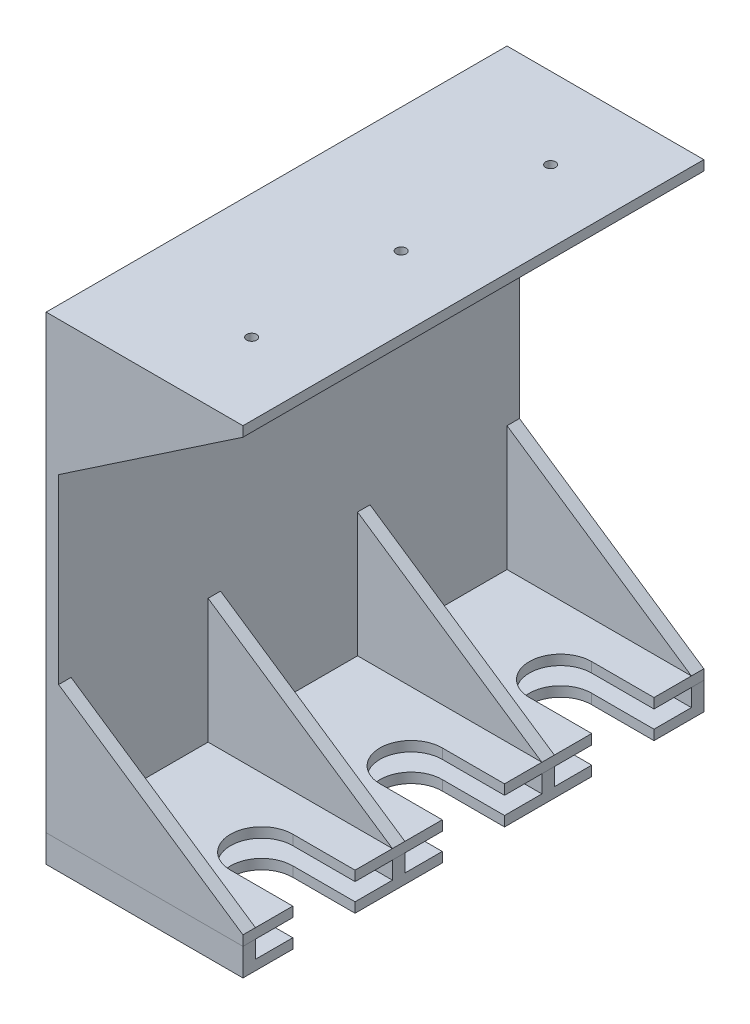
SolidWorks part; units mm, degrees
ref_plane "前视基准面" through (0, 0, 0) normal (0, 0, 1) x (1, 0, 0)
ref_plane "上视基准面" through (0, 0, 0) normal (0, 1, 0) x (1, 0, 0)
ref_plane "右视基准面" through (0, 0, 0) normal (1, 0, 0) x (0, 0, -1)
sketch "草图2" plane through (0, 0, 0) normal (0, 1, 0) x (1, 0, 0)
  line L1 (-1.6914, 66.187) -> (-1.6914, -118.81)
  line L2 (77.3073, -13.812) -> (77.3073, 21.1877)
  line L3 (77.3073, -73.8108) -> (77.3073, -38.8113)
  line L5 (52.2761, 46.1874) -> (77.3073, 46.1874)
  line L7 (52.3077, -13.812) -> (77.3073, -13.812)
  line L18 (52.3077, -38.8113) -> (77.3073, -38.8113)
  line L22 (77.3073, 46.1874) -> (77.3073, 66.187)
  line L28 (52.3077, -98.8102) -> (77.3073, -98.8102)
  line L31 (-1.6914, 66.187) -> (77.3073, 66.187)
  line L34 (52.2761, 21.1877) -> (77.3073, 21.1877)
  line L40 (52.3077, -73.8108) -> (77.3073, -73.8108)
  line L44 (77.3073, -118.81) -> (77.3073, -98.8102)
  line L47 (77.3073, -118.81) -> (-1.6914, -118.81)
  arc A0 (52.2761, 46.1874) -> (52.2761, 21.1877) centre (52.2761, 33.6875) ccw
  arc A1 (52.3077, -13.812) -> (52.3077, -38.8113) centre (52.3077, -26.3116) ccw
  arc A2 (52.3077, -73.8108) -> (52.3077, -98.8102) centre (52.3077, -86.3105) ccw
extrude "凸台-拉伸3" add sketch "草图2" along normal blind 4
ref_plane "基准面9" through (0, 11, 0) normal (0, 1, 0) x (1, 0, 0)
sketch "草图3" plane through (0, 11, 0) normal (0, 1, 0) x (1, 0, 0)
  line L0 (-1.6914, 66.187) -> (-1.6914, -118.81)
  line L1 (77.3073, -13.812) -> (77.3073, 21.1877)
  line L2 (77.3073, -73.8108) -> (77.3073, -38.8113)
  line L3 (52.2761, 46.1874) -> (77.3073, 46.1874)
  line L4 (52.3077, -13.812) -> (77.3073, -13.812)
  line L5 (52.3077, -38.8113) -> (77.3073, -38.8113)
  line L6 (77.3073, 46.1874) -> (77.3073, 66.187)
  line L7 (52.3077, -98.8102) -> (77.3073, -98.8102)
  line L8 (-1.6914, 66.187) -> (77.3073, 66.187)
  line L9 (52.2761, 21.1877) -> (77.3073, 21.1877)
  line L10 (52.3077, -73.8108) -> (77.3073, -73.8108)
  line L11 (77.3073, -118.81) -> (77.3073, -98.8102)
  line L12 (77.3073, -118.81) -> (-1.6914, -118.81)
  arc A0 (52.2761, 46.1874) -> (52.2761, 21.1877) centre (52.2761, 33.6875) ccw
  arc A1 (52.3077, -13.812) -> (52.3077, -38.8113) centre (52.3077, -26.3116) ccw
  arc A2 (52.3077, -73.8108) -> (52.3077, -98.8102) centre (52.3077, -86.3105) ccw
extrude "凸台-拉伸4" add sketch "草图3" along normal blind 4 separate body
sketch "草图4" plane through (0, 4, 0) normal (0, 1, 0) x (1, 0, 0)
  line L0 (2.3086, -113.81) -> (77.3073, -113.81)
  line L1 (-1.6914, 66.187) -> (-1.6914, -118.81) construction
  line L2 (77.3073, -118.81) -> (77.3073, -98.8102) construction
  line L3 (2.3086, -58.81) -> (77.3073, -58.81)
  line L4 (77.3073, -73.8108) -> (77.3073, -38.8113) construction
  line L5 (2.3086, -53.81) -> (77.3073, -53.81)
  line L6 (2.3086, 1.19) -> (77.3073, 1.19)
  line L7 (77.3073, -13.812) -> (77.3073, 21.1877) construction
  line L8 (2.3086, 6.19) -> (77.3073, 6.19)
  line L9 (2.3086, 61.187) -> (77.3073, 61.187)
  line L10 (77.3073, 46.1874) -> (77.3073, 66.187) construction
  line L11 (77.3073, 61.187) -> (77.3073, 66.187)
  line L12 (77.3073, 66.187) -> (-1.6914, 66.187)
  line L13 (-1.6914, 66.187) -> (-1.6914, -118.81)
  line L15 (77.3073, 6.19) -> (77.3073, 1.19)
  line L17 (77.3073, -58.81) -> (77.3073, -53.81)
  line L18 (77.3073, -118.81) -> (77.3073, -113.81)
  line L19 (-1.6914, -118.81) -> (77.3073, -118.81) construction
  line L20 (-1.6914, -118.81) -> (77.3073, -118.81)
  line L23 (2.3086, -113.81) -> (2.3086, -58.81)
  line L24 (2.3086, -53.81) -> (2.3086, 1.19)
  line L25 (2.3086, 6.19) -> (2.3086, 61.187)
  dimension "D1" = 5
  dimension "D3" = 5
  dimension "D5" = 55
  dimension "D6" = 55
  dimension "D7" = 4
extrude "凸台-拉伸5" add sketch "草图4" along normal blind 7
sketch "草图5" plane through (0, 15, 0) normal (0, 1, 0) x (1, 0, 0)
  line L0 (77.3073, 66.187) -> (-1.6914, 66.187) construction
  line L1 (-1.6914, -118.81) -> (3.3086, -118.81)
  line L2 (-1.6914, -118.81) -> (-1.6914, 66.187)
  line L3 (-1.6914, 66.187) -> (3.3086, 66.187)
  line L4 (3.3086, -118.81) -> (3.3086, 66.187)
  dimension "D1" = 5
extrude "凸台-拉伸6" add sketch "草图5" along normal blind 173
ref_plane "基准面10" through (0, 0, 118.81) normal (0, 0, 1) x (1, 0, 0)
sketch "草图6" plane through (0, 0, 118.81) normal (0, 0, 1) x (1, 0, 0)
  line L0 (3.3086, 65) -> (3.3086, 15)
  line L1 (3.3086, 188) -> (3.3086, 15) construction
  line L2 (3.3086, 15) -> (77.3073, 15)
  line L3 (77.3073, 15) -> (3.3086, 65)
  line L4 (3.3086, 188) -> (77.3073, 188)
  line L5 (-1.6914, 188) -> (3.3086, 188) construction
  line L6 (77.3073, 188) -> (3.3086, 138)
  line L7 (3.3086, 138) -> (3.3086, 188)
  dimension "D1" = 50
  dimension "D2" = 50
extrude "凸台-拉伸7" add sketch "草图6" against normal blind 5
ref_plane "基准面11" through (0, 0, 58.81) normal (0, 0, 1) x (1, 0, 0)
sketch "草图7" plane through (0, 0, 58.81) normal (0, 0, 1) x (1, 0, 0)
  line L4 (3.3086, 65) -> (77.3073, 15)
  line L5 (77.3073, 15) -> (3.3086, 15)
  line L6 (3.3086, 15) -> (3.3086, 65)
extrude "凸台-拉伸8" add sketch "草图7" against normal blind 5
ref_plane "基准面12" through (0, 0, -1.19) normal (0, 0, 1) x (1, 0, 0)
sketch "草图8" plane through (0, 0, -1.19) normal (0, 0, 1) x (1, 0, 0)
  line L3 (3.3086, 65) -> (77.3073, 15)
  line L4 (77.3073, 15) -> (3.3086, 65) construction
  line L5 (77.3073, 15) -> (3.3086, 15)
  line L6 (3.3086, 15) -> (3.3086, 65)
extrude "凸台-拉伸9" add sketch "草图8" against normal blind 5
ref_plane "基准面13" through (0, 0, -61.19) normal (0, 0, 1) x (1, 0, 0)
sketch "草图9" plane through (0, 0, -61.19) normal (0, 0, 1) x (1, 0, 0)
  line L0 (3.3086, 138) -> (77.3073, 188)
  line L1 (77.3073, 188) -> (3.3086, 188)
  line L2 (-1.6914, 188) -> (77.3073, 188) construction
  line L3 (3.3086, 188) -> (3.3086, 138)
  line L4 (3.3086, 65) -> (77.3073, 15)
  line L5 (77.3073, 15) -> (3.3086, 15)
  line L6 (3.3086, 15) -> (3.3086, 65)
extrude "凸台-拉伸10" add sketch "草图9" against normal blind 5
sketch "草图10" plane through (0, 188, 0) normal (0, 1, 0) x (1, 0, 0)
  line L0 (77.3073, -113.81) -> (77.3073, -118.81) construction
  line L1 (-1.6914, 66.187) -> (77.3073, 66.187)
  line L2 (-1.6914, 66.187) -> (-1.6914, -118.81)
  line L3 (-1.6914, -118.81) -> (77.3073, -118.81)
  line L4 (77.3073, 66.187) -> (77.3073, -118.81)
extrude "凸台-拉伸11" add sketch "草图10" along normal blind 4
sketch "草图11" plane through (0, 192, 0) normal (0, 1, 0) x (1, 0, 0)
  line L0 (-1.6914, 66.187) -> (-1.6914, -118.81) construction
  line L1 (-1.6914, -118.81) -> (77.3073, -118.81) construction
  circle A0 centre (48.3086, 33.69) radius 2
  circle A1 centre (48.3086, -26.31) radius 2
  circle A2 centre (48.3086, -86.31) radius 2
  point P12 (54.2462, 49.622)
  point P13 (0, 0)
  dimension "D1" = 4
  dimension "D2" = 4
  dimension "D3" = 4
  dimension "D4" = 50
  dimension "D5" = 50
  dimension "D6" = 50
  dimension "D7" = 32.5
  dimension "D8" = 60
  dimension "D9" = 60
extrude "切除-拉伸1" cut sketch "草图11" against normal blind 4
